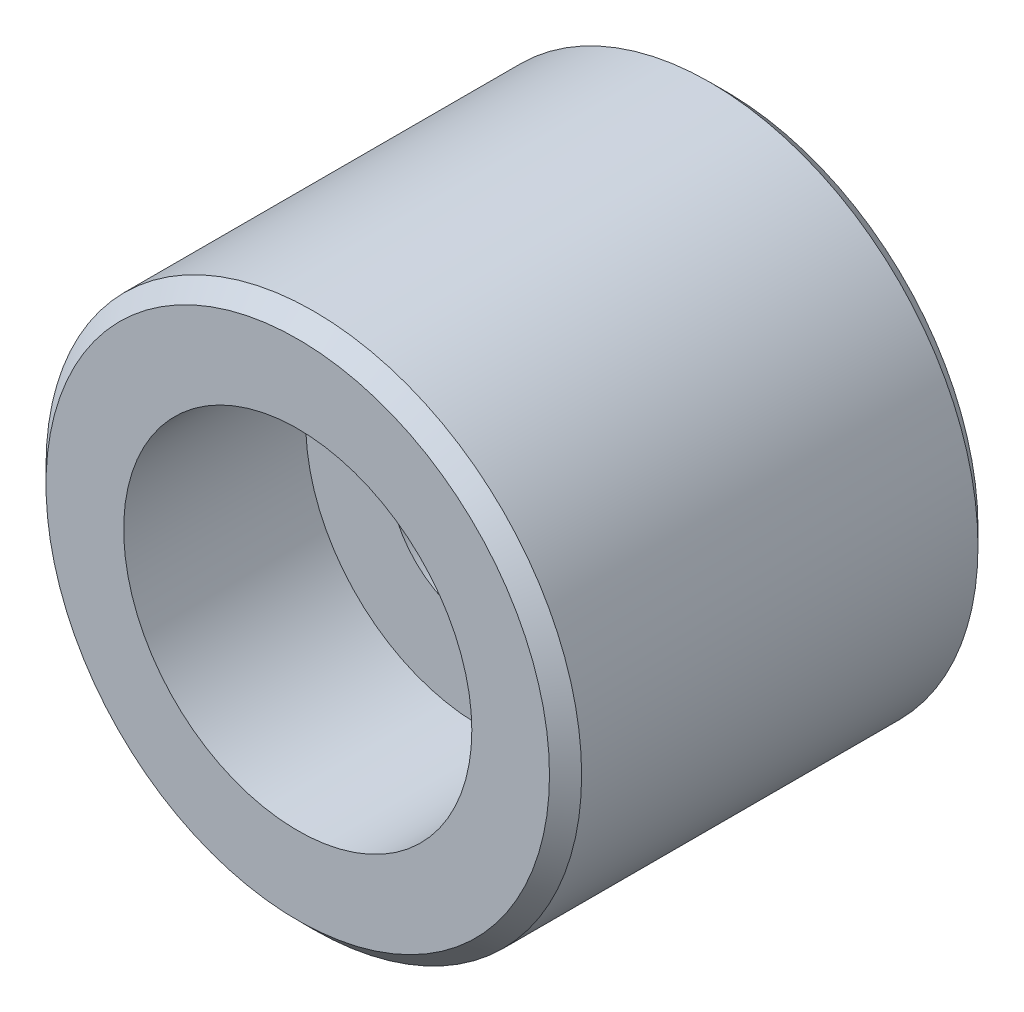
SolidWorks part; units mm, degrees
ref_plane "Ebene vorne" through (0, 0, 0) normal (0, 0, 1) x (1, 0, 0)
ref_plane "Ebene oben" through (0, 0, 0) normal (0, 1, 0) x (1, 0, 0)
ref_plane "Ebene rechts" through (0, 0, 0) normal (1, 0, 0) x (0, 0, -1)
sketch "Skizze1" plane through (0, 0, 0) normal (0, 0, 1) x (1, 0, 0)
  circle A0 centre (0, 0) radius 5
  dimension "D1" = 10
extrude "Aufsatz-Linear austragen1" add sketch "Skizze1" along normal blind 8
hole_wizard "Stirnsenkung für M3 Zylinderschraube mit Innensechskant1" positions "Skizze2" profile "Skizze4" counterbore size "M3" standard "DIN"
sketch "Skizze2" plane through (0, 0, 8) normal (0, 0, 1) x (1, 0, 0)
  point P0 (0, 0)
sketch "Skizze4" plane through (0, 0, 8) normal (1, 0, 0) x (0, -1, 0)
  line L0 (0, 0) -> (0, 8)
  line L1 (0, 8) -> (1.7, 8)
  line L3 (1.7, 8) -> (1.7, 3.4)
  line L4 (1.7, 3.4) -> (3.25, 3.4)
  line L5 (3.25, 3.4) -> (3.25, 0)
  line L7 (3.25, 0) -> (0, 0)
  line L11 (0, -6.35) -> (0, 107.95) construction
  dimension "Bohrerdurchmesser" = 3.4
  dimension "Bohrungstiefe" = 8
  dimension "Senkdurchmesser2" = 6.5
  dimension "Senktiefe2" = 3.4
chamfer "Fase1" distance 0.3 angle 45 3 edges at (5, 0, 0) (1.7, 0, 0) (5, 0, 8)
